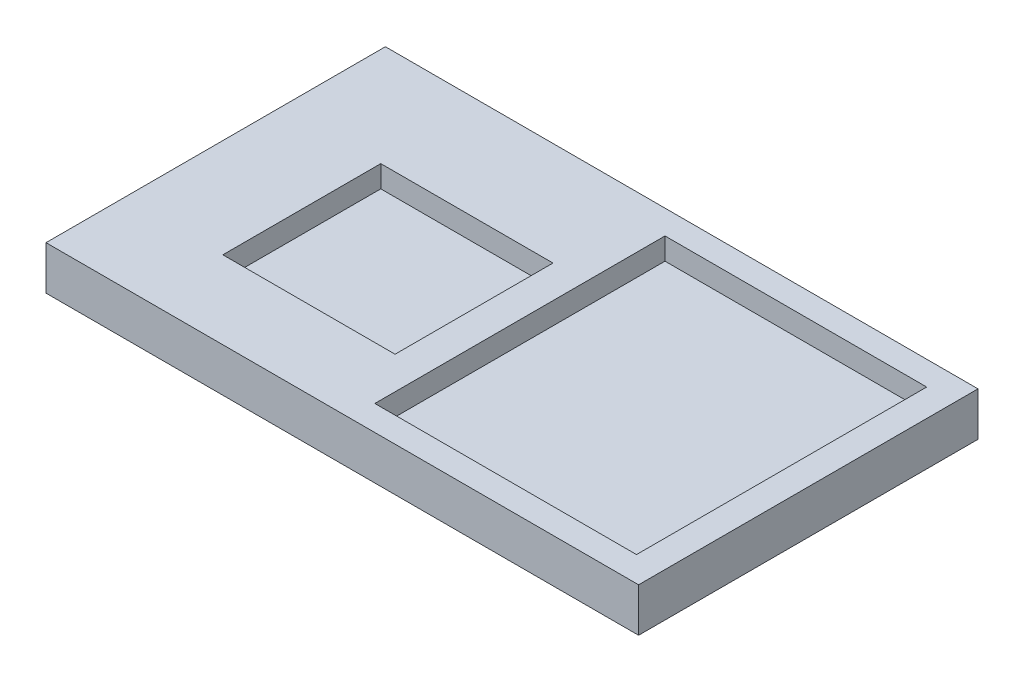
SolidWorks part; units mm, degrees
ref_plane "Front Plane" through (0, 0, 0) normal (0, 0, 1) x (1, 0, 0)
ref_plane "Top Plane" through (0, 0, 0) normal (0, 1, 0) x (1, 0, 0)
ref_plane "Right Plane" through (0, 0, 0) normal (1, 0, 0) x (0, 0, -1)
sketch "Sketch1" plane through (0, 0, 0) normal (0, 1, 0) x (1, 0, 0)
  line L1 (-72.2568, 49.122) -> (99.8285, 49.122)
  line L2 (-72.2568, 49.122) -> (-72.2568, -49.4389)
  line L3 (-72.2568, -49.4389) -> (99.8285, -49.4389)
  line L4 (99.8285, 49.122) -> (99.8285, -49.4389)
extrude "Extrude1" add sketch "Sketch1" along normal blind 12.7
sketch "Sketch2" plane through (0, 12.7, 0) normal (0, 1, 0) x (-1, 0, 0)
  line L1 (43.5258, -19.049) -> (-6.4827, -19.049)
  line L2 (43.5258, -19.049) -> (43.5258, 26.813)
  line L3 (43.5258, 26.813) -> (-6.4827, 26.813)
  line L4 (-6.4827, -19.049) -> (-6.4827, 26.813)
extrude "Cut-Extrude1" cut sketch "Sketch2" against normal blind 6.35
sketch "Sketch3" plane through (0, 12.7, 0) normal (0, 1, 0) x (-1, 0, 0)
  line L1 (-91.9229, -42.1275) -> (-15.9308, -42.1275)
  line L2 (-91.9229, -42.1275) -> (-91.9229, 42.138)
  line L3 (-91.9229, 42.138) -> (-15.9308, 42.138)
  line L4 (-15.9308, -42.1275) -> (-15.9308, 42.138)
extrude "Cut-Extrude2" cut sketch "Sketch3" against normal blind 6.35
